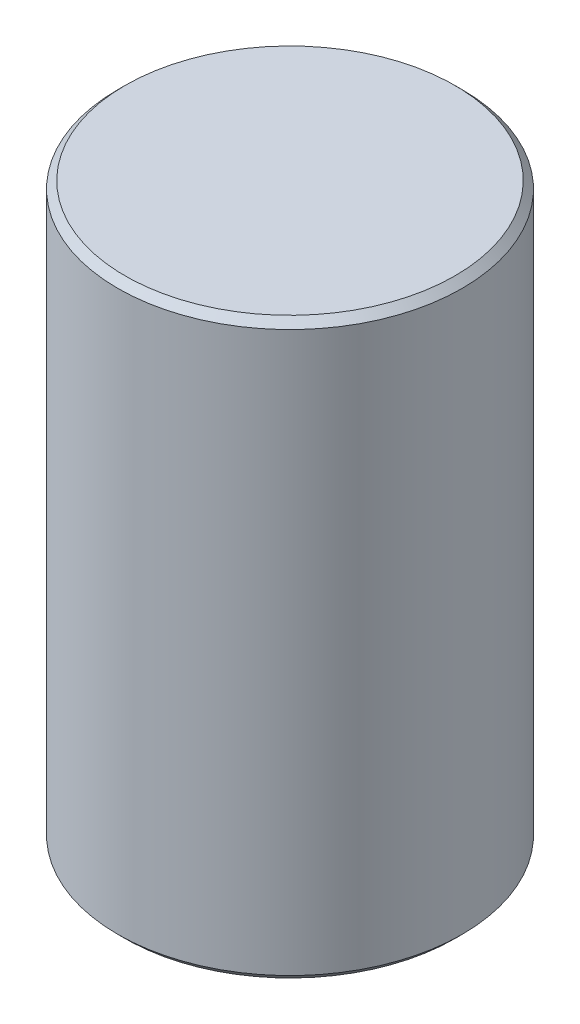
SolidWorks part; units mm, degrees
ref_plane "Front Plane" through (0, 0, 0) normal (0, 0, 1) x (1, 0, 0)
ref_plane "Top Plane" through (0, 0, 0) normal (0, 1, 0) x (1, 0, 0)
ref_plane "Right Plane" through (0, 0, 0) normal (1, 0, 0) x (0, 0, -1)
sketch "Sketch1" plane through (0, 0, 0) normal (0, 0, 1) x (1, 0, 0)
  line L0 (0, 127) -> (0, 0) construction
  line L2 (0, 0) -> (38.1, 0)
  line L3 (0, 0) -> (0, 127)
  line L4 (0, 127) -> (38.1, 127)
  line L5 (38.1, 0) -> (38.1, 127)
  dimension "D" = 76.2
  dimension "L" = 127
revolve "Revolve1" add sketch "Sketch1" angle 360 about L0
chamfer "Chamfer1" distance 1.6002 angle 45 2 edges at (-38.1, 0, 0) (-38.1, 127, 0)
hole_wizard "3/8-16 Tapped Hole1" positions "Sketch3" profile "Sketch2" tap size "3/8-16" standard "ANSI Inch"
sketch "Sketch3" plane through (0, 0, 0) normal (0, -1, 0) x (-1, 0, 0)
  point P0 (0, 0)
sketch "Sketch2" plane through (0, 0, 0) normal (1, 0, 0) x (0, 0, -1)
  line L0 (0, 0) -> (0, 23.0222)
  line L1 (0, 23.0222) -> (3.9687, 20.6375)
  line L2 (3.9687, 20.6375) -> (3.9687, 0)
  line L5 (3.9687, 0) -> (0, 0)
  line L10 (0, 23.0222) -> (-3.9688, 20.6375) construction
  line L11 (0, -6.35) -> (0, 107.95) construction
  dimension "Tap Drill Dia." = 7.9375
  dimension "Tap Drill Depth" = 20.6375
  dimension "Drill Angle" = 118
ref_plane "Plane1" through (0, 63.5, 0) normal (0, 1, 0) x (1, 0, 0)
hole_wizard "5/8-11 Tapped Hole1" positions "Sketch5" profile "Sketch4" tap size "5/8-11" standard "ANSI Inch"
sketch "Sketch5" plane through (0, 0, 0) normal (0, -1, 0) x (-1, 0, 0)
  point P0 (0, 0)
sketch "Sketch4" plane through (0, 0, 0) normal (1, 0, 0) x (0, 0, -1)
  line L0 (0, 0) -> (0, 42.7377)
  line L1 (0, 42.7377) -> (6.7462, 38.6842)
  line L2 (6.7462, 38.6842) -> (6.7462, 0)
  line L5 (6.7462, 0) -> (0, 0)
  line L10 (0, 42.7377) -> (-6.7462, 38.6842) construction
  line L11 (0, -6.35) -> (0, 107.95) construction
  dimension "Tap Drill Dia." = 13.4925
  dimension "Tap Drill Depth" = 38.6842
  dimension "Drill Angle" = 118
mirror "Mirror1" [suppressed] about plane through (0, 63.5, 0) normal (0, 1, 0)
mirror "Mirror2" [suppressed] about plane through (0, 63.5, 0) normal (0, 1, 0)
